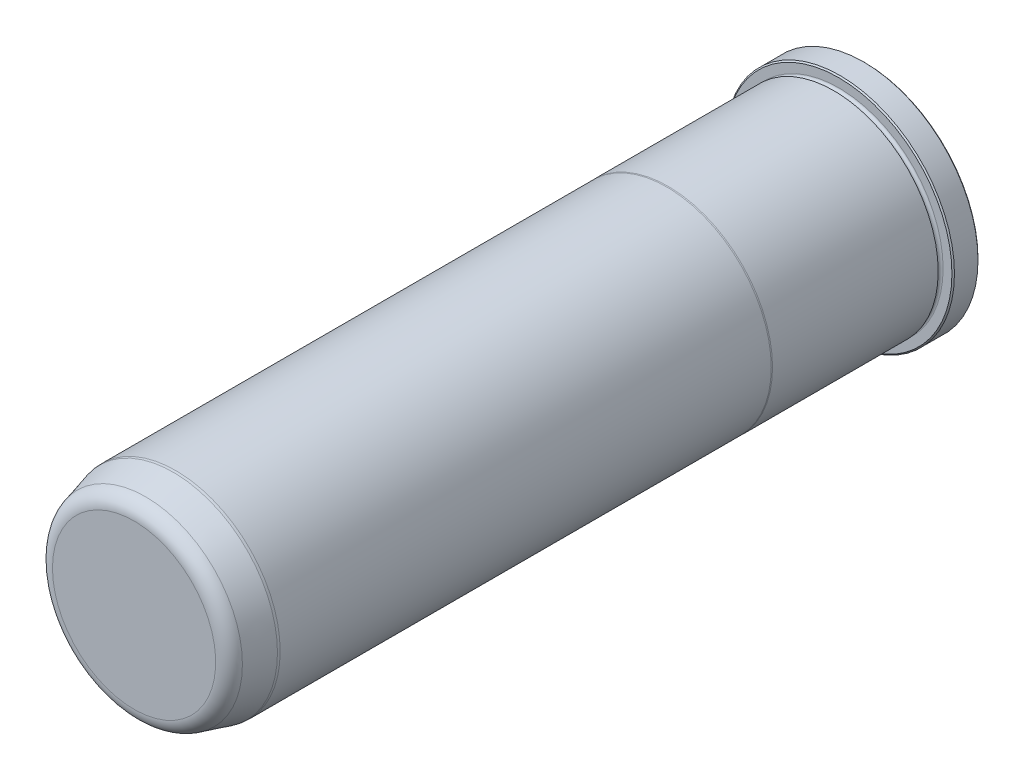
SolidWorks part; units mm, degrees
ref_plane "Front Plane" through (0, 0, 0) normal (0, 0, 1) x (1, 0, 0)
ref_plane "Top Plane" through (0, 0, 0) normal (0, 1, 0) x (1, 0, 0)
ref_plane "Right Plane" through (0, 0, 0) normal (1, 0, 0) x (0, 0, -1)
sketch "Sketch1" plane through (0, 0, 0) normal (1, 0, 0) x (0, 0, -1)
  line L0 (0, 0) -> (0, 34.798)
  line L1 (0, 34.798) -> (-7.9248, 34.798)
  line L2 (-7.9248, 34.798) -> (-7.9248, 31.7373)
  line L3 (-7.9248, 30.9753) -> (-9.4488, 30.9753) construction
  line L4 (-9.4488, 31.7373) -> (-9.4488, 31.7627)
  line L5 (-9.4488, 31.7627) -> (-59.8348, 31.7627)
  line L6 (-59.8348, 31.7627) -> (-60.198, 31.7373)
  line L7 (-60.198, 31.7373) -> (-209.55, 31.7373)
  line L9 (-222.25, 28.4719) -> (-222.25, 0)
  line L10 (-222.25, 0) -> (0, 0)
  line L11 (0, 0) -> (13.6287, 0) construction
  line L12 (-209.55, 31.7373) -> (-210.312, 31.6706)
  line L13 (-210.312, 31.6706) -> (-222.25, 28.4719)
  arc A0 (-9.4488, 31.7373) -> (-7.9248, 31.7373) centre (-8.6868, 31.7373) ccw
  dimension "D14" = 1.524
  dimension "D1" = 7.9248
  dimension "D2" = 1.524
  dimension "D3" = 69.596
  dimension "D4" = 63.5254
  dimension "D5" = 60.198
  dimension "D6" = 222.25
  dimension "D7" = 0.7874
  dimension "D8" = 4
  dimension "D9" = 63.4746
  dimension "D10" = 5
  dimension "D11" = 15
  dimension "D12" = 0.762
  dimension "D13" = 12.7
revolve "Revolve1" add sketch "Sketch1" angle 360 about L11
fillet "Fillet6" radius 4.7625 1 edges at (28.4719, 0, 222.25)
chamfer "Chamfer1" distance 0.381 angle 45 2 edges at (34.798, 0, 0) (34.798, 0, 7.9248)
